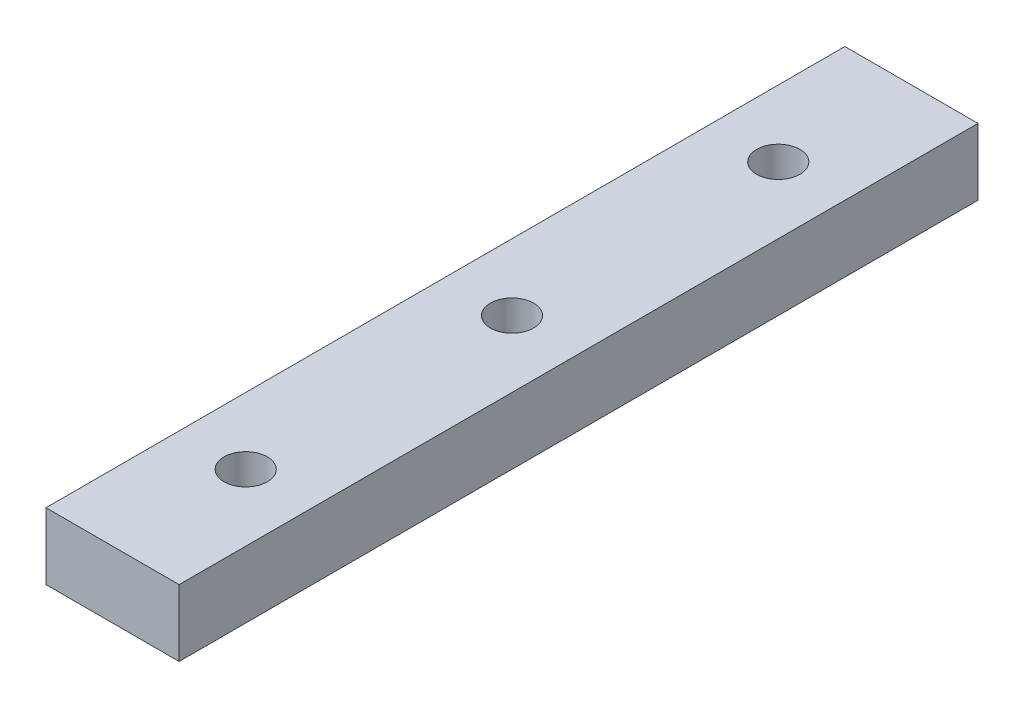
SolidWorks part; units mm, degrees
ref_plane "Plan de face" through (0, 0, 0) normal (0, 0, 1) x (1, 0, 0)
ref_plane "Plan de dessus" through (0, 0, 0) normal (0, 1, 0) x (1, 0, 0)
ref_plane "Plan de droite" through (0, 0, 0) normal (1, 0, 0) x (0, 0, -1)
sketch "Esquisse1" plane through (0, 0, 0) normal (0, 0, 1) x (1, 0, 0)
  line L1 (0, 0) -> (20, 0)
  line L2 (0, 0) -> (0, 10)
  line L3 (0, 10) -> (20, 10)
  line L4 (20, 0) -> (20, 10)
  dimension "D1" = 20
  dimension "D2" = 10
extrude "Extrusion1" add sketch "Esquisse1" against normal blind 120
sketch "Esquisse3" plane through (0, 10, 0) normal (0, 1, 0) x (-1, 0, 0)
  line L0 (-10, -120) -> (-10, 5.0116) construction
  line L1 (-20, -120) -> (0, -120) construction
  line L2 (4.4772, -60) -> (-24.9469, -60) construction
  circle A0 centre (-10, -60) radius 3.25
  dimension "D1" = 6.5
extrude "Enlèv. mat.-Extru.1" cut sketch "Esquisse3" against normal blind 10
pattern_linear "Répétition linéaire1" count 2 spacing 40 along (0, 0, 1) count 2 spacing 40 along (0, 0, -1) of "Enlèv. mat.-Extru.1"
